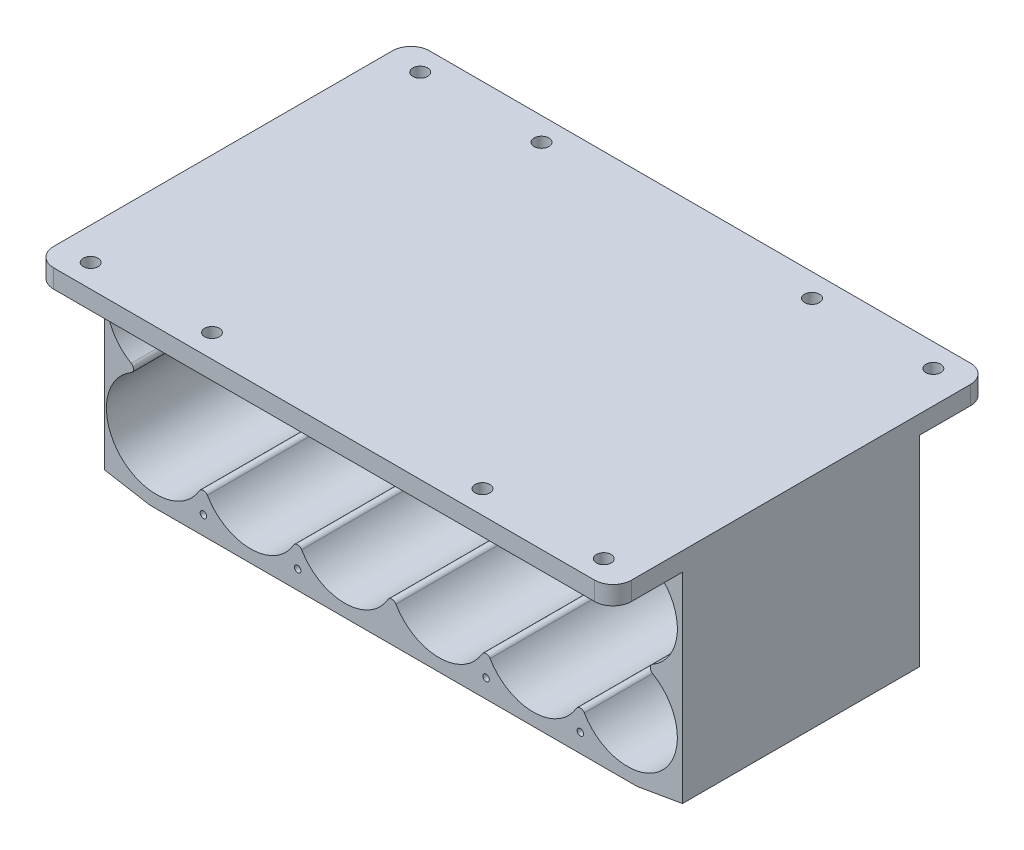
SolidWorks part; units mm, degrees
ref_plane "Front Plane" through (0, 0, 0) normal (0, 0, 1) x (1, 0, 0)
ref_plane "Top Plane" through (0, 0, 0) normal (0, 1, 0) x (1, 0, 0)
ref_plane "Right Plane" through (0, 0, 0) normal (1, 0, 0) x (0, 0, -1)
sketch "Sketch1" plane through (0, 0, 0) normal (0, 1, 0) x (1, 0, 0)
  line L1 (0, 0) -> (156, 0)
  line L2 (0, 0) -> (0, 65)
  line L3 (0, 65) -> (156, 65)
  line L4 (156, 0) -> (156, 65)
  dimension "D1" = 65
  dimension "D2" = 156
extrude "Boss-Extrude1" add sketch "Sketch1" along normal blind 1.27
sketch "Sketch2" plane through (0, 0, 0) normal (-1, 0, 0) x (0, 0, 1)
  line L1 (0, 1.27) -> (-65, 1.27)
  line L2 (0, 1.27) -> (0, -50.73)
  line L3 (0, -50.73) -> (-65, -50.73)
  line L4 (-65, 1.27) -> (-65, -50.73)
  dimension "D1" = 52
extrude "Boss-Extrude2" add sketch "Sketch2" along normal blind 1.27
sketch "Sketch3" plane through (156, 0, 0) normal (1, 0, 0) x (0, 0, -1)
  line L0 (65, -50.73) -> (0, -50.73) construction
  line L1 (65, 1.27) -> (0, 1.27)
  line L2 (65, 1.27) -> (65, -50.73)
  line L3 (65, -50.73) -> (0, -50.73)
  line L4 (0, 1.27) -> (0, -50.73)
extrude "Boss-Extrude3" add sketch "Sketch3" along normal blind 1.27
sketch "Sketch5" plane through (0, 0, -65) normal (0, 0, -1) x (-1, 0, 0)
  line L0 (-51.7, -12.925) -> (-51.7, 0) construction
  line L1 (-156, 0) -> (0, 0) construction
  line L2 (-77.55, -12.925) -> (-77.55, 0) construction
  line L3 (-25.85, -12.925) -> (-25.85, 0) construction
  line L4 (-103.4, -12.925) -> (-103.4, 0) construction
  line L5 (-129.25, -12.925) -> (-129.25, 0) construction
  line L6 (-69.1281, 0) -> (-85.9719, 0)
  line L7 (-142.175, -25.85) -> (-156, -25.85) construction
  line L8 (-156, -50.73) -> (-156, 0) construction
  line L9 (-12.925, -25.85) -> (0, -25.85) construction
  line L10 (0, 0) -> (0, -50.73) construction
  line L12 (-156, -38.775) -> (-156, 0)
  line L13 (-156, 0) -> (-146.6781, 0)
  line L14 (-120.8281, 0) -> (-137.6719, 0)
  line L15 (-94.9781, 0) -> (-111.8219, 0)
  line L16 (-43.2781, 0) -> (-60.1219, 0)
  line L17 (-17.4281, 0) -> (-34.2719, 0)
  line L18 (0, -8.4219) -> (0, 0)
  line L19 (0, 0) -> (-8.4219, 0)
  line L20 (0, -34.2719) -> (0, -17.4281)
  line L21 (-155.862, -38.775) -> (-156, -38.775)
  circle A0 centre (-38.775, -12.925) radius 12.925 construction
  circle A1 centre (-64.625, -12.925) radius 12.925 construction
  circle A2 centre (-90.475, -12.925) radius 12.925 construction
  circle A3 centre (-12.925, -12.925) radius 12.925 construction
  circle A5 centre (-116.325, -12.925) radius 12.925 construction
  circle A6 centre (-142.175, -12.925) radius 12.925 construction
  arc A7 (-77.55, -8.4219) -> (-85.9719, 0) centre (-90.475, -12.925) ccw
  arc A8 (-77.55, -8.4219) -> (-69.1281, 0) centre (-64.625, -12.925) cw
  circle A9 centre (-142.175, -38.775) radius 12.925 construction
  arc A10 (-8.4219, -25.85) -> (0, -34.2719) centre (-12.925, -38.775) cw
  circle A11 centre (-12.925, -38.775) radius 12.925 construction
  arc A12 (-8.4219, -25.85) -> (0, -17.4281) centre (-12.925, -12.925) ccw
  arc A13 (0, -8.4219) -> (-8.4219, 0) centre (-12.925, -12.925) ccw
  arc A14 (-17.4281, 0) -> (-25.85, -8.4219) centre (-12.925, -12.925) ccw
  arc A15 (-25.85, -8.4219) -> (-34.2719, 0) centre (-38.775, -12.925) ccw
  arc A16 (-51.7, -8.4219) -> (-43.2781, 0) centre (-38.775, -12.925) cw
  arc A17 (-51.7, -8.4219) -> (-60.1219, 0) centre (-64.625, -12.925) ccw
  arc A18 (-94.9781, 0) -> (-103.4, -8.4219) centre (-90.475, -12.925) ccw
  arc A19 (-103.4, -8.4219) -> (-111.8219, 0) centre (-116.325, -12.925) ccw
  arc A20 (-129.25, -8.4219) -> (-120.8281, 0) centre (-116.325, -12.925) cw
  arc A21 (-129.25, -8.4219) -> (-137.6719, 0) centre (-142.175, -12.925) ccw
  arc A22 (-146.6781, 0) -> (-155.862, -12.925) centre (-142.175, -12.925) ccw
  arc A23 (-146.6781, -25.85) -> (-155.862, -38.775) centre (-142.175, -38.775) ccw
  arc A24 (-146.6781, -25.85) -> (-155.862, -12.925) centre (-142.175, -12.925) cw
  dimension "D1" = 0.762
  dimension "D2" = 0.762
  dimension "D3" = 0.762
  dimension "D4" = 0.762
  dimension "D5" = 0.762
  dimension "D6" = 0.762
  dimension "D7" = 0.762
  dimension "D8" = 0.762
  dimension "D9" = 0.762
extrude "Boss-Extrude4" add sketch "Sketch5" against normal up to surface (65 mm away)
sketch "Sketch6" plane through (0, 0, -65) normal (0, 0, -1) x (-1, 0, 0)
  line L0 (0, -50.73) -> (-11.43, -52.705)
  line L1 (-11.43, -52.705) -> (-144.57, -52.705)
  line L2 (-144.57, -52.705) -> (-156, -50.73)
  line L3 (1.27, -50.73) -> (0, -50.73)
  line L4 (-156, -50.73) -> (-157.27, -50.73)
  line L5 (-157.27, -50.73) -> (-157.27, -53.7326)
  line L6 (-157.27, -53.7326) -> (-144.8423, -55.88)
  line L7 (-144.8423, -55.88) -> (-11.1577, -55.88)
  line L8 (-11.1577, -55.88) -> (1.27, -53.7326)
  line L9 (1.27, -53.7326) -> (1.27, -50.73)
  line L10 (1.27, 1.27) -> (1.27, -50.73) construction
  line L11 (-157.27, 1.27) -> (1.27, 1.27) construction
  line L12 (-157.27, -50.73) -> (-157.27, 1.27) construction
  dimension "D1" = 57.15
  dimension "D2" = 12.7
  dimension "D3" = 12.7
  dimension "D4" = 3.175
  dimension "D5" = 3.175
  dimension "D6" = 3.175
extrude "Boss-Extrude5" add sketch "Sketch6" against normal up to surface (65 mm away)
sketch "Sketch7" plane through (0, 0, -65) normal (0, 0, -1) x (-1, 0, 0)
  line L0 (0, -34.2719) -> (0, -50.73) construction
  line L1 (-155.8526, -39.283) -> (-155.862, -38.775)
  line L2 (-155.862, -38.775) -> (-156, -38.775)
  line L3 (-156, -38.775) -> (-156, -50.73)
  line L4 (-156, -50.73) -> (-144.57, -52.705)
  line L5 (-144.57, -52.705) -> (-11.43, -52.705)
  line L6 (-11.43, -52.705) -> (0, -50.73)
  line L7 (0, -50.73) -> (0, -43.2781)
  arc A0 (0, -43.2781) -> (-25.85, -43.2781) centre (-12.925, -38.775) cw
  arc A1 (-25.85, -43.2781) -> (-51.7, -43.2781) centre (-38.775, -38.775) cw
  arc A2 (-51.7, -43.2781) -> (-77.55, -43.2781) centre (-64.625, -38.775) cw
  arc A3 (-77.55, -43.2781) -> (-103.4, -43.2781) centre (-90.475, -38.775) cw
  arc A4 (-103.4, -43.2781) -> (-129.25, -43.2781) centre (-116.325, -38.775) cw
  arc A5 (-129.25, -43.2781) -> (-155.8526, -39.283) centre (-142.175, -38.775) cw
  circle A6 centre (-12.925, -38.775) radius 12.925 construction
  circle A7 centre (-38.775, -38.775) radius 12.925 construction
  circle A8 centre (-64.625, -38.775) radius 12.925 construction
  circle A9 centre (-90.475, -38.775) radius 12.925 construction
  circle A10 centre (-116.325, -38.775) radius 12.925 construction
  circle A12 centre (-142.175, -38.775) radius 12.925 construction
  dimension "D1" = 0.762
  dimension "D2" = 0.762
  dimension "D3" = 0.762
  dimension "D4" = 0.762
  dimension "D5" = 0.762
  dimension "D6" = 0.762
  dimension "D7" = 0.508
extrude "Boss-Extrude6" add sketch "Sketch7" against normal up to surface (65 mm away)
fillet "Fillet2" radius 1.27 12 edges at (8.4219, -25.85, -32.5) (25.85, -8.4219, -32.5) (51.7, -8.4219, -32.5) (77.55, -8.4219, -32.5) (103.4, -8.4219, -32.5) (129.25, -8.4219, -32.5) (146.6781, -25.85, -32.5) (129.25, -43.2781, -32.5) (103.4, -43.2781, -32.5) (77.55, -43.2781, -32.5) (51.7, -43.2781, -32.5) (25.85, -43.2781, -32.5)
sketch "Sketch13" plane through (0, 1.27, 0) normal (0, 1, 0) x (1, 0, 0)
  line L0 (-1.27, 65) -> (-1.27, 84.05)
  line L1 (-1.27, 84.05) -> (157.27, 84.05)
  line L2 (157.27, 84.05) -> (157.27, 65)
  line L3 (157.27, 65) -> (157.27, 0) construction
  line L4 (-1.27, 65) -> (-1.27, 0)
  line L5 (-1.27, 0) -> (-1.27, -19.05)
  line L6 (-1.27, -19.05) -> (157.27, -19.05)
  line L7 (157.27, -19.05) -> (157.27, 0)
  line L8 (157.27, 65) -> (157.27, 0)
  dimension "D1" = 19.05
  dimension "D2" = 19.05
extrude "Boss-Extrude10" add sketch "Sketch13" along normal blind 5.08
fillet "Fillet3" radius 5.08 4 edges at (-1.27, 3.81, -84.05) (-1.27, 3.81, 19.05) (157.27, 3.81, -84.05) (157.27, 3.81, 19.05)
sketch "Sketch14" plane through (0, 1.27, 0) normal (0, -1, 0) x (-1, 0, 0)
  line L0 (-3.81, -19.05) -> (-3.81, 0) construction
  line L1 (1.27, 0) -> (-11.1577, 0) construction
  line L2 (-3.81, -12.7) -> (-157.27, -12.7) construction
  line L4 (-157.27, -13.97) -> (-157.27, 0) construction
  line L5 (1.27, 0) -> (1.27, -13.97) construction
  line L6 (-78, -19.05) -> (-78, 0) construction
  line L7 (-3.81, -19.05) -> (-152.19, -19.05) construction
  line L8 (-11.1577, 0) -> (-144.8423, 0) construction
  line L9 (-78, 0) -> (-3.81, 0) construction
  line L10 (-40.905, 0) -> (-40.905, -19.05) construction
  line L11 (-157.27, 32.5) -> (1.27, 32.5) construction
  line L12 (-157.27, 0) -> (-157.27, 65) construction
  line L13 (1.27, 0) -> (1.27, 65) construction
  line L14 (-40.905, 65) -> (-40.905, 84.05) construction
  line L15 (-78, 65) -> (-3.81, 65) construction
  line L16 (-78, 84.05) -> (-78, 65) construction
  line L17 (-3.81, 77.7) -> (-157.27, 77.7) construction
  line L18 (-3.81, 84.05) -> (-3.81, 65) construction
  circle A0 centre (-148.38, -12.7) radius 2.032
  circle A1 centre (-7.62, -12.7) radius 2.032
  circle A2 centre (-115.095, 77.7) radius 2.032
  circle A4 centre (-40.905, -12.7) radius 2.032
  circle A5 centre (-115.095, -12.7) radius 2.032
  circle A6 centre (-40.905, 77.7) radius 2.032
  circle A8 centre (-7.62, 77.7) radius 2.032
  circle A9 centre (-148.38, 77.7) radius 2.032
  dimension "D1" = 4.064
  dimension "D2" = 8.89
  dimension "D3" = 8.89
  dimension "D4" = 6.35
extrude "Cut-Extrude3" cut sketch "Sketch14" against normal through all
sketch "Sketch15" plane through (157.27, 0, 0) normal (1, 0, 0) x (0, 0, -1)
  line L0 (32.5, 6.35) -> (32.5, -55.88) construction
  line L1 (-13.97, 6.35) -> (78.97, 6.35) construction
  line L2 (0, -55.88) -> (65, -55.88) construction
  line L3 (37.072, 6.35) -> (37.072, 4.826)
  line L4 (37.072, 4.826) -> (27.928, 4.826)
  line L5 (27.928, 6.35) -> (27.928, 4.826)
  line L6 (37.072, 6.35) -> (27.928, 6.35)
  point P11 (32.5, 4.826)
  dimension "D1" = 4.572
  dimension "D2" = 4.572
  dimension "D3" = 1.524
sketch "Sketch16" plane through (0, 0, -65) normal (0, 0, -1) x (-1, 0, 0)
  line L0 (-11.4437, -50.8) -> (-135.6379, -50.8) construction
  line L1 (-25.85, -46.302) -> (-25.85, -50.8) construction
  line L2 (-51.7, -46.302) -> (-51.7, -50.8) construction
  line L3 (-103.4, -46.302) -> (-103.4, -50.8) construction
  line L4 (-129.25, -46.302) -> (-129.25, -50.8) construction
  line L5 (1.27, -26.2313) -> (-157.27, -26.2313) construction
  line L6 (1.27, 1.27) -> (1.27, -53.7326) construction
  line L7 (-157.27, 6.35) -> (-157.27, -55.88) construction
  line L8 (-11.4437, -1.6626) -> (-135.6379, -1.6626) construction
  line L9 (-144.8423, -55.88) -> (-11.1577, -55.88) construction
  arc A1 (-155.8526, -39.283) -> (-130.3475, -45.6629) centre (-142.175, -38.775) ccw construction
  circle A2 centre (-25.85, -50.8) radius 0.889
  circle A3 centre (-51.7, -50.8) radius 0.889
  circle A4 centre (-129.25, -1.6626) radius 0.889
  circle A5 centre (-103.4, -50.8) radius 0.889
  circle A6 centre (-129.25, -50.8) radius 0.889
  circle A7 centre (-103.4, -1.6626) radius 0.889
  circle A8 centre (-51.7, -1.6626) radius 0.889
  circle A9 centre (-25.85, -1.6626) radius 0.889
  dimension "D1" = 1.778
  dimension "D2" = 5.08
extrude "Cut-Extrude5" cut sketch "Sketch16" against normal through all
sketch "Sketch18" plane through (0, -55.88, 0) normal (0, -1, 0) x (-1, 0, 0)
  line L0 (-24.13, 39.6) -> (-128.9492, 39.6) construction
  line L1 (1.27, 0) -> (1.27, 65) construction
  line L2 (-144.8423, 65) -> (-11.1577, 65) construction
  line L3 (-30.48, 52.3) -> (-138.034, 52.3) construction
  text T0 "BATTERY MODULE 100 WH" font "Century Gothic" height in points 24
  text T1 " COMPLIES WITH FAA 49 CFR 175.10(a)(18)" font "Century Gothic" height in points 14
  dimension "D1" = 25.4
  dimension "D2" = 25.4
  dimension "D3" = 31.75
  dimension "D4" = 12.7
extrude "Cut-Extrude7" cut sketch "Sketch18" against normal blind 1.016
sketch "Sketch17" plane through (0, 0, -84.05) normal (0, 0, -1) x (-1, 0, 0)
  line L0 (-80.725, 6.35) -> (-80.725, 3.175)
  line L1 (-152.19, 6.35) -> (-3.81, 6.35) construction
  line L2 (-80.725, 3.175) -> (-77.55, 3.175)
  line L3 (-77.55, 3.175) -> (-77.55, -52.705)
  line L4 (-77.55, -52.705) -> (-80.725, -52.705)
  line L5 (-80.725, -52.705) -> (-80.725, -55.88)
  line L6 (-144.8423, -55.88) -> (-11.1577, -55.88) construction
  line L7 (-77.55, -6.668) -> (-77.55, -45.032) construction
  line L8 (-80.725, 6.35) -> (1.27, 6.35)
  line L9 (1.27, 6.35) -> (1.27, -55.88)
  line L10 (1.27, -55.88) -> (-80.725, -55.88)
  arc A0 (-78.6475, -6.0371) -> (-76.4525, -6.0371) centre (-77.55, -5.398) ccw construction
  arc A1 (-76.4525, -45.6629) -> (-78.6475, -45.6629) centre (-77.55, -46.302) ccw construction
  dimension "D1" = 3.175
  dimension "D2" = 3.175
  dimension "D3" = 3.175
  dimension "D4" = 3.175
sketch "Sketch20" plane through (0, 0, -65) normal (0, 0, -1) x (-1, 0, 0)
  line L0 (-26.612, -38.775) -> (-142.175, -38.775)
  line L1 (-142.175, -38.775) -> (-142.175, -26.612)
  arc A0 (-129.25, -8.4219) -> (-142.175, -26.612) centre (-142.175, -12.925) ccw
  arc A1 (-103.4, -8.4219) -> (-129.25, -8.4219) centre (-116.325, -12.925) ccw
  arc A2 (-77.55, -8.4219) -> (-103.4, -8.4219) centre (-90.475, -12.925) ccw
  arc A3 (-120.8281, 0) -> (-128.1525, -6.0371) centre (-116.325, -12.925) ccw construction
  arc A4 (-130.3475, -6.0371) -> (-137.6719, 0) centre (-142.175, -12.925) ccw construction
  arc A5 (-78.6475, -6.0371) -> (-85.9719, 0) centre (-90.475, -12.925) ccw construction
  arc A6 (-51.7, -8.4219) -> (-77.55, -8.4219) centre (-64.625, -12.925) ccw
  arc A7 (-25.85, -8.4219) -> (-51.7, -8.4219) centre (-38.775, -12.925) ccw
  arc A8 (-8.4219, -25.85) -> (-25.85, -8.4219) centre (-12.925, -12.925) ccw
  arc A9 (-69.1281, 0) -> (-76.4525, -6.0371) centre (-64.625, -12.925) ccw construction
  arc A10 (-43.2781, 0) -> (-50.6025, -6.0371) centre (-38.775, -12.925) ccw construction
  arc A11 (-17.4281, 0) -> (-24.7525, -6.0371) centre (-12.925, -12.925) ccw construction
  arc A12 (-26.612, -38.775) -> (-8.4219, -25.85) centre (-12.925, -38.775) ccw
  arc A13 (-24.7525, -45.6629) -> (0, -43.2781) centre (-12.925, -38.775) ccw construction
extrude "Cut-Extrude8" cut sketch "Sketch20" against normal through all
sketch "Sketch22" plane through (-1.27, 0, 0) normal (-1, 0, 0) x (0, 0, 1)
  line L0 (-78.97, 6.35) -> (13.97, 6.35) construction
  line L1 (-65, 6.35) -> (0, 6.35)
  line L2 (-65, 6.35) -> (-65, -53.7326)
  line L3 (-65, -53.7326) -> (0, -53.7326)
  line L4 (0, 6.35) -> (0, -53.7326)
  line L5 (-65, 1.27) -> (-65, -53.7326) construction
sketch "Sketch23" plane through (157.27, 0, 0) normal (1, 0, 0) x (0, 0, -1)
  line L0 (0, 1.27) -> (0, -53.7326) construction
  line L1 (65, -53.7326) -> (0, -53.7326)
  line L2 (65, -53.7326) -> (65, 6.35)
  line L3 (65, 6.35) -> (0, 6.35)
  line L4 (0, -53.7326) -> (0, 6.35)
  line L5 (-13.97, 6.35) -> (78.97, 6.35) construction
